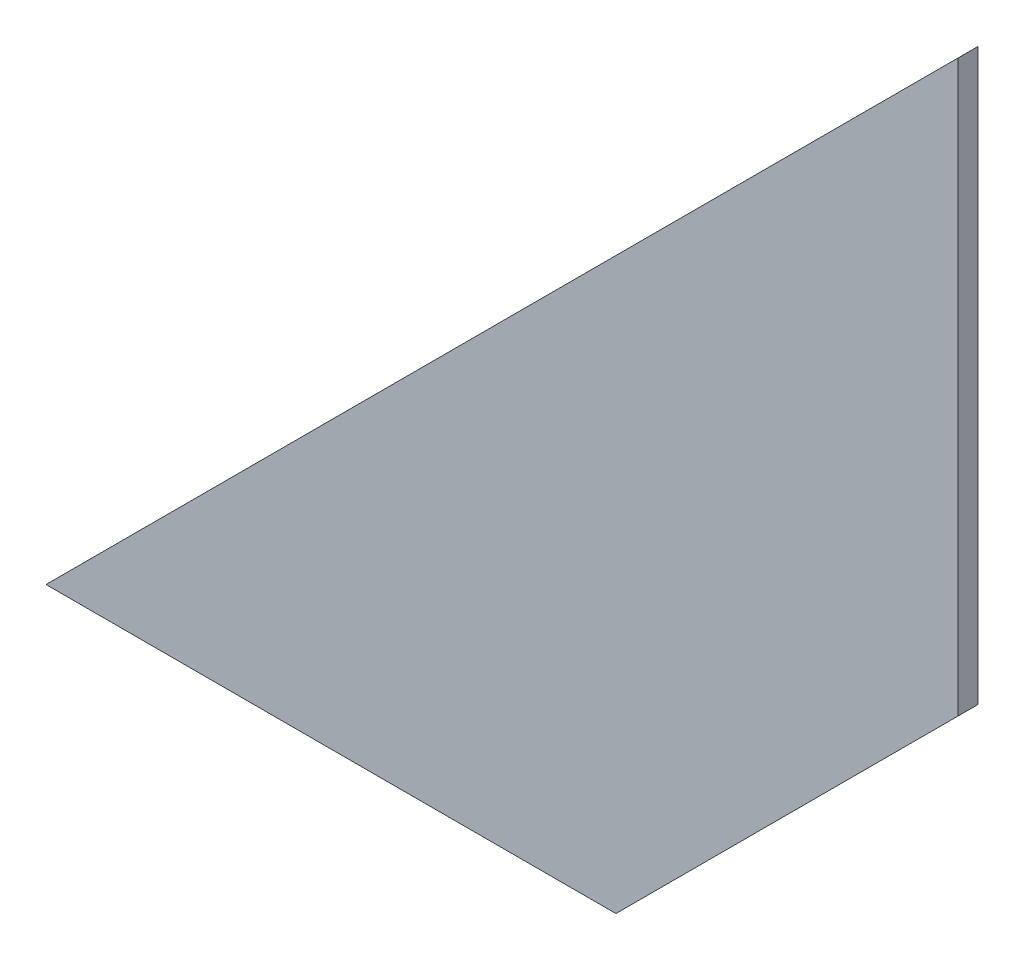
SolidWorks part; units mm, degrees
ref_plane "Plan de face" through (0, 0, 0) normal (0, 0, 1) x (1, 0, 0)
ref_plane "Plan de dessus" through (0, 0, 0) normal (0, 1, 0) x (1, 0, 0)
ref_plane "Plan de droite" through (0, 0, 0) normal (1, 0, 0) x (0, 0, -1)
sketch "Esquisse1" plane through (0, 0, 0) normal (0, 0, 1) x (1, 0, 0)
  line L0 (0, 0) -> (282.8427, 0)
  line L1 (282.8427, 0) -> (452.5483, 169.7056)
  line L2 (452.5483, 169.7056) -> (452.5483, 452.5483)
  line L3 (452.5483, 452.5483) -> (0, 0)
  dimension "D1" = 45
  dimension "D2" = 200
  dimension "D3" = 640
extrude "Boss.-Extru.1" add sketch "Esquisse1" along normal blind 10
equation "\"éà\"=33.504"
